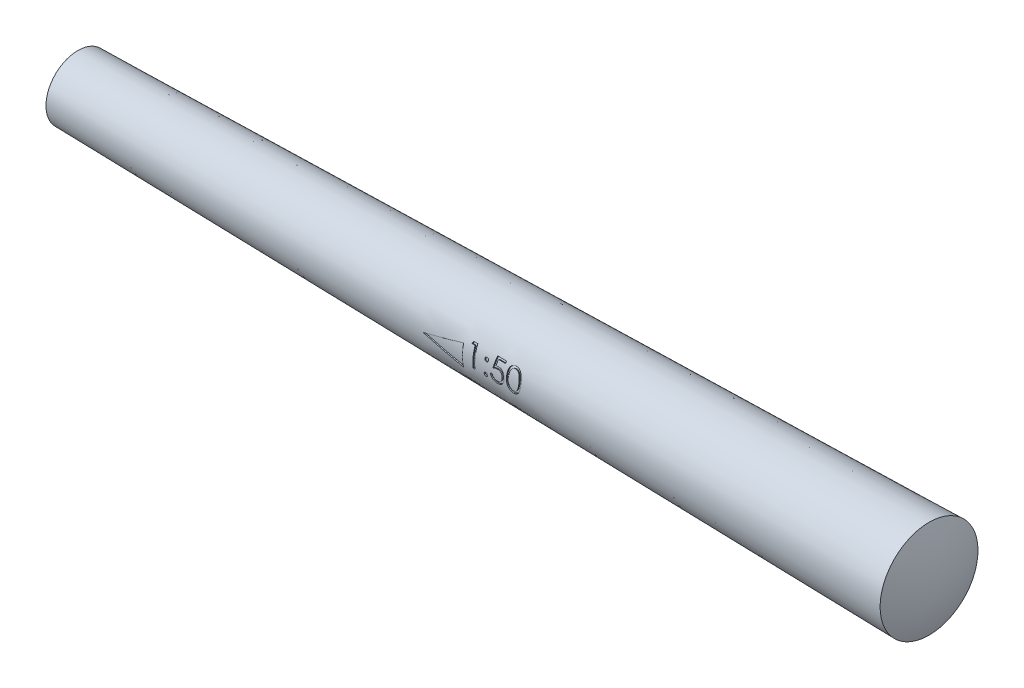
SolidWorks part; units mm, degrees
ref_plane "Front Plane" through (0, 0, 0) normal (0, 0, 1) x (1, 0, 0)
ref_plane "Top Plane" through (0, 0, 0) normal (0, 1, 0) x (1, 0, 0)
ref_plane "Right Plane" through (0, 0, 0) normal (1, 0, 0) x (0, 0, -1)
sketch "Sketch1" plane through (0, 0, 0) normal (1, 0, 0) x (0, 0, -1)
  circle A0 centre (0, 0) radius 1.5
  dimension "D1" = 3
extrude "Extrude1" add sketch "Sketch1" along normal mid plane 40
draft "Draft1" type of draft neutral plane draft angle 1.146 faces to draft 1 parameters "D1"=1.146
sketch "Sketch2" plane through (0, 0, 0) normal (0, 0, 1) x (1, 0, 0)
  line L0 (-20, 0) -> (-20, 1.5)
  line L1 (-20, 1.5) -> (-20, -1.5) construction
  line L2 (-20, 0) -> (-20.45, 0)
  line L3 (-20.45, 0) -> (-20.45, -1.9) construction
  line L4 (20, 0) -> (20, 2.3)
  line L5 (20, -2.3) -> (20, 2.3) construction
  line L6 (20, 0) -> (20.45, 0)
  line L7 (20.45, 0) -> (20.45, -1.9) construction
  line L8 (-20, -1.5) -> (20, -2.3) construction
  arc A0 (-20.45, 0) -> (-20, 1.5) centre (-17.725, 0) cw
  arc A1 (20.45, 0) -> (20, 2.3) centre (14.3471, 0) ccw
  point P14 (0, -1.9)
revolve "Revolve1" add sketch "Sketch2" angle 360 about L2
sketch "Sketch5" plane through (0, 0, 0) normal (0, 0, 1) x (1, 0, 0)
  line L0 (0, 1.9) -> (0, -1.9) construction
  line L1 (20, 2.3) -> (-20, 1.5) construction
  line L2 (-20, -1.5) -> (20, -2.3) construction
ref_plane "Plane2" through (0, 0, 0) normal (-0.02, 0, 0.9998) x (0.9998, 0, 0.02)
sketch "Sketch6" plane through (0, 0, 0) normal (-0.02, 0, 0.9998) x (0.9998, 0, 0.02)
  line L0 (0, 0) -> (0, 0.5)
  line L1 (0, 1.9) -> (0, -1.9) construction
  line L2 (0, 0.5) -> (-1.866, 0)
  line L3 (-1.866, 0) -> (0, -0.5)
  line L4 (0, -0.5) -> (0, 0)
  line L5 (0, -0.25) -> (3, -0.25) construction
  text T0 "1:50" font "Century Gothic" height 1
  dimension "D1" = 1
  dimension "D2" = 30
  dimension "D3" = 3
wrap "Wrap2" sketch "Sketch6" wrap type deboss source sketch "Sketch6" thickness 0.05 parameters "D1"=0.05
equation "\"D2@Sketch2\" = \"D1@Sketch2\""
